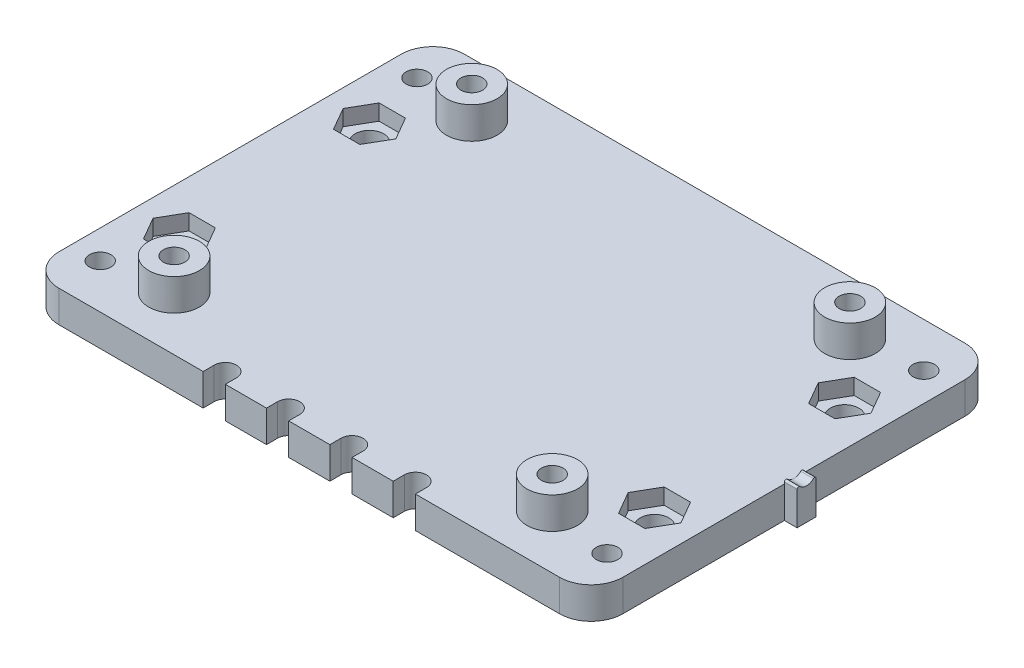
SolidWorks part; units mm, degrees
ref_plane "Front Plane" through (0, 0, 0) normal (0, 0, 1) x (1, 0, 0)
ref_plane "Top Plane" through (0, 0, 0) normal (0, 1, 0) x (1, 0, 0)
ref_plane "Right Plane" through (0, 0, 0) normal (1, 0, 0) x (0, 0, -1)
sketch "PCB outline" plane through (0, 0, 0) normal (0, 1, 0) x (1, 0, 0)
  line L0 (-29.845, 23.495) -> (29.845, 23.495) construction
  line L1 (-33.655, -27.305) -> (33.655, -27.305) construction
  line L2 (-33.655, -27.305) -> (-33.655, 27.305) construction
  line L3 (-33.655, 27.305) -> (33.655, 27.305) construction
  line L4 (33.655, -27.305) -> (33.655, 27.305) construction
  line L5 (-33.655, -27.305) -> (33.655, 27.305) construction
  line L6 (-33.655, 27.305) -> (33.655, -27.305) construction
  line L7 (29.845, 23.495) -> (29.845, -23.495) construction
  line L8 (29.845, -23.495) -> (-29.845, -23.495) construction
  line L9 (-29.845, -23.495) -> (-29.845, 23.495) construction
  line L10 (0, 23.495) -> (0, 0) construction
  line L11 (-29.845, 0) -> (0, 0) construction
  circle A0 centre (-29.845, 23.495) radius 1.7145 construction
  circle A1 centre (29.845, 23.495) radius 1.7145 construction
  circle A2 centre (29.845, -23.495) radius 1.7145 construction
  circle A3 centre (-29.845, -23.495) radius 1.7145 construction
  point P0 (0, 0)
  dimension "D3" = 3.429
  dimension "D1" = 67.31
  dimension "D2" = 54.61
  dimension "D4" = 46.99
  dimension "D5" = 59.69
sketch "Sketch1" plane through (0, 0, 0) normal (0, 1, 0) x (1, 0, 0)
  line L5 (-44.5, -32) -> (44.5, -32)
  line L6 (-44.5, -32) -> (-44.5, 32)
  line L7 (-44.5, 32) -> (44.5, 32)
  line L8 (44.5, -32) -> (44.5, 32)
  line L9 (-44.5, -32) -> (44.5, 32) construction
  line L10 (-44.5, 32) -> (44.5, -32) construction
  point P0 (0, 0)
  dimension "D1" = 64
  dimension "D2" = 89
extrude "Boss-Extrude1" add sketch "Sketch1" along normal blind 5
sketch "Sketch3" plane through (0, 5, 0) normal (0, 1, 0) x (1, 0, 0)
  circle A0 centre (-29.845, 23.495) radius 4
  circle A1 centre (29.845, 23.495) radius 4
  circle A2 centre (-29.845, -23.495) radius 4
  circle A3 centre (29.845, -23.495) radius 4
  dimension "D1" = 8
extrude "Boss-Extrude2" add sketch "Sketch3" along normal blind 5
sketch "Sketch4" plane through (0, 5, 0) normal (0, 1, 0) x (1, 0, 0)
  line L0 (-16.75, -30.25) -> (-16.75, -32)
  line L1 (-44.5, -32) -> (44.5, -32) construction
  line L2 (-16.75, -32) -> (-13.25, -32)
  line L3 (-13.25, -32) -> (-13.25, -30.25)
  line L4 (-3.25, -32) -> (-3.25, -30.25)
  line L5 (-6.75, -30.25) -> (-6.75, -32)
  line L6 (-6.75, -32) -> (-3.25, -32)
  line L7 (6.75, -32) -> (6.75, -30.25)
  line L8 (3.25, -30.25) -> (3.25, -32)
  line L9 (3.25, -32) -> (6.75, -32)
  line L10 (16.75, -32) -> (16.75, -30.25)
  line L11 (13.25, -30.25) -> (13.25, -32)
  line L12 (13.25, -32) -> (16.75, -32)
  line L13 (-44.5, 32) -> (-44.5, -32) construction
  arc A0 (-13.25, -30.25) -> (-16.75, -30.25) centre (-15, -30.25) ccw
  arc A1 (-3.25, -30.25) -> (-6.75, -30.25) centre (-5, -30.25) ccw
  arc A2 (6.75, -30.25) -> (3.25, -30.25) centre (5, -30.25) ccw
  arc A3 (16.75, -30.25) -> (13.25, -30.25) centre (15, -30.25) ccw
  circle A5 centre (-29.845, 23.495) radius 4 construction
  dimension "D1" = 1.75
  dimension "D2" = 1.75
  dimension "D3" = 15
  dimension "D5" = 10
  dimension "D4" = 4
extrude "Cut-Extrude1" cut sketch "Sketch4" against normal blind 5
sketch "Sketch6" plane through (0, 5, 0) normal (0, 1, 0) x (1, 0, 0)
  line L0 (-37.5, 15) -> (-37.5, -15) construction
  line L1 (-33.3431, 15) -> (-35.4215, 18.6)
  line L2 (-35.4215, 18.6) -> (-39.5785, 18.6)
  line L3 (-39.5785, 18.6) -> (-41.6569, 15)
  line L4 (-41.6569, 15) -> (-39.5785, 11.4)
  line L5 (-39.5785, 11.4) -> (-35.4215, 11.4)
  line L6 (-35.4215, 11.4) -> (-33.3431, 15)
  line L7 (-33.3431, -15) -> (-35.4215, -11.4)
  line L8 (-35.4215, -11.4) -> (-39.5785, -11.4)
  line L9 (-39.5785, -11.4) -> (-41.6569, -15)
  line L10 (-41.6569, -15) -> (-39.5785, -18.6)
  line L11 (-39.5785, -18.6) -> (-35.4215, -18.6)
  line L12 (-35.4215, -18.6) -> (-33.3431, -15)
  line L13 (41.6569, -15) -> (39.5785, -11.4)
  line L14 (39.5785, -11.4) -> (35.4215, -11.4)
  line L15 (35.4215, -11.4) -> (33.3431, -15)
  line L16 (33.3431, -15) -> (35.4215, -18.6)
  line L17 (35.4215, -18.6) -> (39.5785, -18.6)
  line L18 (39.5785, -18.6) -> (41.6569, -15)
  line L19 (41.6569, 15) -> (39.5785, 18.6)
  line L20 (39.5785, 18.6) -> (35.4215, 18.6)
  line L21 (35.4215, 18.6) -> (33.3431, 15)
  line L22 (33.3431, 15) -> (35.4215, 11.4)
  line L23 (35.4215, 11.4) -> (39.5785, 11.4)
  line L24 (39.5785, 11.4) -> (41.6569, 15)
  line L25 (-37.5, -15) -> (37.5, -15) construction
  line L26 (37.5, -15) -> (37.5, 15) construction
  line L27 (37.5, 15) -> (-37.5, 15) construction
  circle A0 centre (-37.5, 15) radius 3.6 construction
  circle A1 centre (-37.5, -15) radius 3.6 construction
  circle A2 centre (37.5, -15) radius 3.6 construction
  circle A3 centre (37.5, 15) radius 3.6 construction
  point P25 (-37.5, 11.4)
  dimension "D1" = 30
  dimension "D2" = 7.2
  dimension "D3" = 75
  dimension "D4" = 37.5
  dimension "D5" = 15
extrude "Cut-Extrude2" cut sketch "Sketch6" against normal blind 2.5
hole_wizard "M4 Clearance Hole1" positions "Sketch7" profile "Sketch8" hole size "M4" standard "ANSI Metric"
sketch "Sketch7" plane through (0, 5, 0) normal (0, 1, 0) x (1, 0, 0)
  point P0 (-37.5, 15)
  point P3 (37.5, 15)
  point P6 (37.5, -15)
  point P9 (-37.5, -15)
sketch "Sketch8" plane through (-37.5, 5, -15) normal (1, 0, 0) x (0, 0, 1)
  line L0 (0, 0) -> (0, 5)
  line L1 (0, 5) -> (2.25, 5)
  line L2 (2.25, 5) -> (2.25, 0)
  line L5 (2.25, 0) -> (0, 0)
  line L11 (0, -6.35) -> (0, 107.95) construction
  dimension "Thru Hole Dia." = 4.5
  dimension "Thru Hole Depth" = 5
hole_wizard "M3 Clearance Hole1" positions "Sketch9" profile "Sketch10" hole size "M3" standard "ANSI Metric"
sketch "Sketch9" plane through (0, 10, 0) normal (0, 1, 0) x (1, 0, 0)
  point P0 (-29.845, 23.495)
  point P3 (29.845, 23.495)
  point P6 (29.845, -23.495)
  point P9 (-29.845, -23.495)
sketch "Sketch10" plane through (-29.845, 10, -23.495) normal (1, 0, 0) x (0, 0, 1)
  line L0 (0, 0) -> (0, 10)
  line L1 (0, 10) -> (1.7, 10)
  line L2 (1.7, 10) -> (1.7, 0)
  line L5 (1.7, 0) -> (0, 0)
  line L11 (0, -6.35) -> (0, 107.95) construction
  dimension "Thru Hole Dia." = 3.4
  dimension "Thru Hole Depth" = 10
sketch "Sketch11" plane through (0, 0, 0) normal (0, -1, 0) x (1, 0, 0)
  line L1 (26.5252, -23.495) -> (28.1851, -26.37)
  line L2 (28.1851, -26.37) -> (31.5049, -26.37)
  line L3 (31.5049, -26.37) -> (33.1648, -23.495)
  line L4 (33.1648, -23.495) -> (31.5049, -20.62)
  line L5 (31.5049, -20.62) -> (28.1851, -20.62)
  line L6 (28.1851, -20.62) -> (26.5252, -23.495)
  line L7 (-33.1648, -23.495) -> (-31.5049, -26.37)
  line L8 (-31.5049, -26.37) -> (-28.1851, -26.37)
  line L9 (-28.1851, -26.37) -> (-26.5252, -23.495)
  line L10 (-26.5252, -23.495) -> (-28.1851, -20.62)
  line L11 (-28.1851, -20.62) -> (-31.5049, -20.62)
  line L12 (-31.5049, -20.62) -> (-33.1648, -23.495)
  line L13 (-33.1648, 23.495) -> (-31.5049, 20.62)
  line L14 (-31.5049, 20.62) -> (-28.1851, 20.62)
  line L15 (-28.1851, 20.62) -> (-26.5252, 23.495)
  line L16 (-26.5252, 23.495) -> (-28.1851, 26.37)
  line L17 (-28.1851, 26.37) -> (-31.5049, 26.37)
  line L18 (-31.5049, 26.37) -> (-33.1648, 23.495)
  line L19 (26.5252, 23.495) -> (28.1851, 20.62)
  line L20 (28.1851, 20.62) -> (31.5049, 20.62)
  line L21 (31.5049, 20.62) -> (33.1648, 23.495)
  line L22 (33.1648, 23.495) -> (31.5049, 26.37)
  line L23 (31.5049, 26.37) -> (28.1851, 26.37)
  line L24 (28.1851, 26.37) -> (26.5252, 23.495)
  circle A0 centre (29.845, -23.495) radius 2.875 construction
  circle A1 centre (-29.845, -23.495) radius 2.875 construction
  circle A2 centre (-29.845, 23.495) radius 2.875 construction
  circle A3 centre (29.845, 23.495) radius 2.875 construction
  dimension "D1" = 5.75
extrude "Cut-Extrude3" cut sketch "Sketch11" against normal blind 2.5
sketch "Lid mounting holes" plane through (0, 0, 0) normal (0, 1, 0) x (1, 0, 0)
  line L1 (-40, -25) -> (40, -25) construction
  line L2 (-40, -25) -> (-40, 25) construction
  line L3 (-40, 25) -> (40, 25) construction
  line L4 (40, -25) -> (40, 25) construction
  line L5 (-40, -25) -> (40, 25) construction
  line L6 (-40, 25) -> (40, -25) construction
  point P0 (0, 0)
  dimension "D1" = 80
  dimension "D2" = 50
sketch "Sketch13" plane through (0, 0, 0) normal (0, -1, 0) x (1, 0, 0)
  line L1 (40, -28.3198) -> (42.875, -26.6599)
  line L2 (42.875, -26.6599) -> (42.875, -23.3401)
  line L3 (42.875, -23.3401) -> (40, -21.6802)
  line L4 (40, -21.6802) -> (37.125, -23.3401)
  line L5 (37.125, -23.3401) -> (37.125, -26.6599)
  line L6 (37.125, -26.6599) -> (40, -28.3198)
  line L7 (40, 21.6802) -> (42.875, 23.3401)
  line L8 (42.875, 23.3401) -> (42.875, 26.6599)
  line L9 (42.875, 26.6599) -> (40, 28.3198)
  line L10 (40, 28.3198) -> (37.125, 26.6599)
  line L11 (37.125, 26.6599) -> (37.125, 23.3401)
  line L12 (37.125, 23.3401) -> (40, 21.6802)
  line L13 (-40, 21.6802) -> (-37.125, 23.3401)
  line L14 (-37.125, 23.3401) -> (-37.125, 26.6599)
  line L15 (-37.125, 26.6599) -> (-40, 28.3198)
  line L16 (-40, 28.3198) -> (-42.875, 26.6599)
  line L17 (-42.875, 26.6599) -> (-42.875, 23.3401)
  line L18 (-42.875, 23.3401) -> (-40, 21.6802)
  line L19 (-40, -28.3198) -> (-37.125, -26.6599)
  line L20 (-37.125, -26.6599) -> (-37.125, -23.3401)
  line L21 (-37.125, -23.3401) -> (-40, -21.6802)
  line L22 (-40, -21.6802) -> (-42.875, -23.3401)
  line L23 (-42.875, -23.3401) -> (-42.875, -26.6599)
  line L24 (-42.875, -26.6599) -> (-40, -28.3198)
  circle A0 centre (40, -25) radius 2.875 construction
  circle A1 centre (40, 25) radius 2.875 construction
  circle A2 centre (-40, 25) radius 2.875 construction
  circle A3 centre (-40, -25) radius 2.875 construction
  dimension "D1" = 5.75
extrude "Cut-Extrude4" cut sketch "Sketch13" against normal blind 2.5
hole_wizard "M3 Clearance Hole2" positions "Sketch16" profile "Sketch17" hole size "M3" standard "ANSI Metric"
sketch "Sketch16" plane through (0, 0, 0) normal (0, -1, 0) x (-1, 0, 0)
  point P0 (40, 25)
  point P3 (40, -25)
  point P6 (-40, -25)
  point P9 (-40, 25)
sketch "Sketch17" plane through (-40, 0, -25) normal (1, 0, 0) x (0, 0, -1)
  line L0 (0, 0) -> (0, 10)
  line L1 (0, 10) -> (1.7, 10)
  line L2 (1.7, 10) -> (1.7, 0)
  line L5 (1.7, 0) -> (0, 0)
  line L11 (0, -6.35) -> (0, 107.95) construction
  dimension "Thru Hole Dia." = 3.4
  dimension "Thru Hole Depth" = 10
sketch "Sketch18" plane through (44.5, 0, 0) normal (1, 0, 0) x (0, 0, -1)
  line L0 (-1.5, 6.5) -> (-1.5, 0)
  line L1 (-32, 0) -> (32, 0) construction
  line L2 (-1.5, 0) -> (1.5, 0)
  line L3 (1.5, 0) -> (1.5, 6.5)
  line L4 (-32, 5) -> (32, 5) construction
  arc A0 (1.5, 6.5) -> (-1.5, 6.5) centre (0, 6.5) cw
  point P7 (0, 0)
  dimension "D1" = 1.5
extrude "Boss-Extrude3" add sketch "Sketch18" along normal blind 2
fillet "Fillet1" radius 0.25 2 edges at (45.5, 6.5, -1.5) (45.5, 6.5, 1.5)
fillet "Fillet2" radius 5 4 edges at (-44.5, 2.5, 32) (44.5, 2.5, 32) (44.5, 2.5, -32) (-44.5, 2.5, -32)
